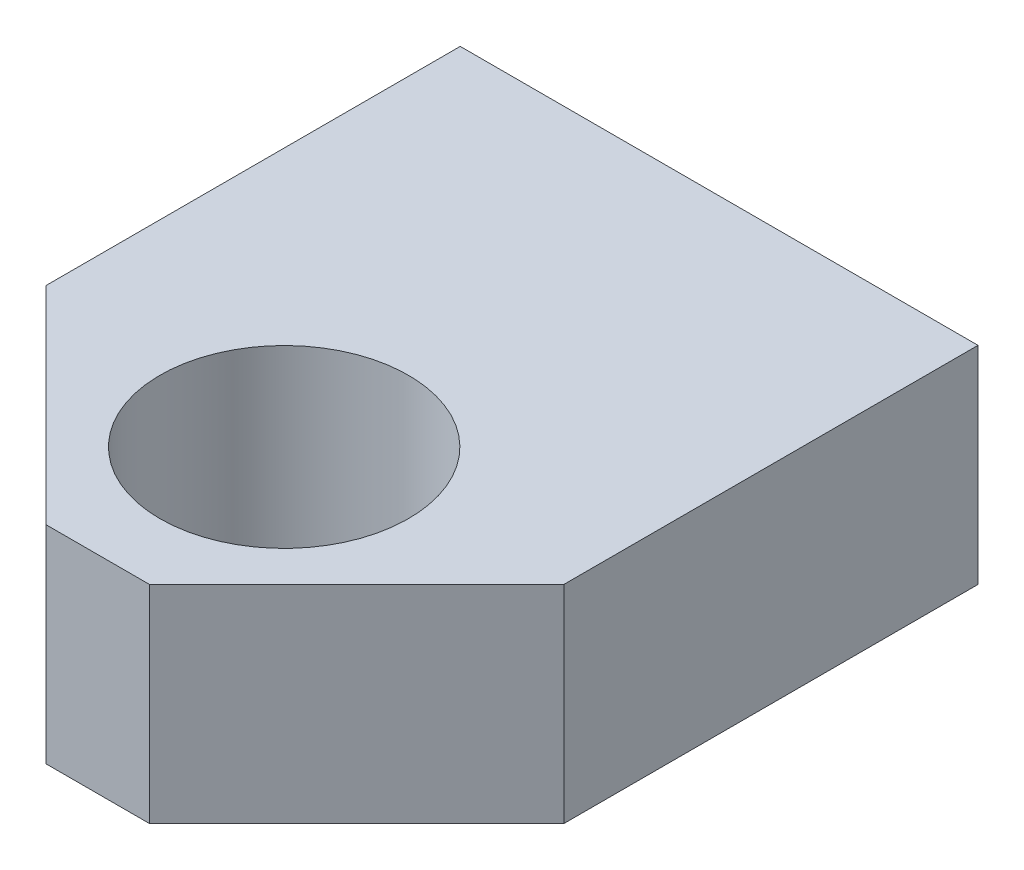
SolidWorks part; units mm, degrees
ref_plane "Plan de face" through (0, 0, 0) normal (0, 0, 1) x (1, 0, 0)
ref_plane "Plan de dessus" through (0, 0, 0) normal (0, 1, 0) x (1, 0, 0)
ref_plane "Plan de droite" through (0, 0, 0) normal (1, 0, 0) x (0, 0, -1)
sketch "Esquisse1" plane through (0, 0, 0) normal (0, 0, 1) x (1, 0, 0)
  line L1 (-12.5, 0) -> (12.5, 0)
  line L2 (-12.5, 0) -> (-12.5, -10)
  line L3 (-12.5, -10) -> (12.5, -10)
  line L4 (12.5, 0) -> (12.5, -10)
  dimension "D1" = 25
  dimension "D2" = 10
extrude "Boss.-Extru.1" add sketch "Esquisse1" along normal blind 30
chamfer "Chanfrein1" distance 10 angle 45 2 edges at (-12.5, -5, 30) (12.5, -5, 30)
sketch "Esquisse2" plane through (0, 0, 0) normal (0, 1, 0) x (1, 0, 0)
  line L0 (12.5, 0) -> (-12.5, 0) construction
  circle A0 centre (0, -21) radius 6
  dimension "D2" = 12
  dimension "D1" = 21
extrude "Enlèv. mat.-Extru.1" cut sketch "Esquisse2" against normal through all
